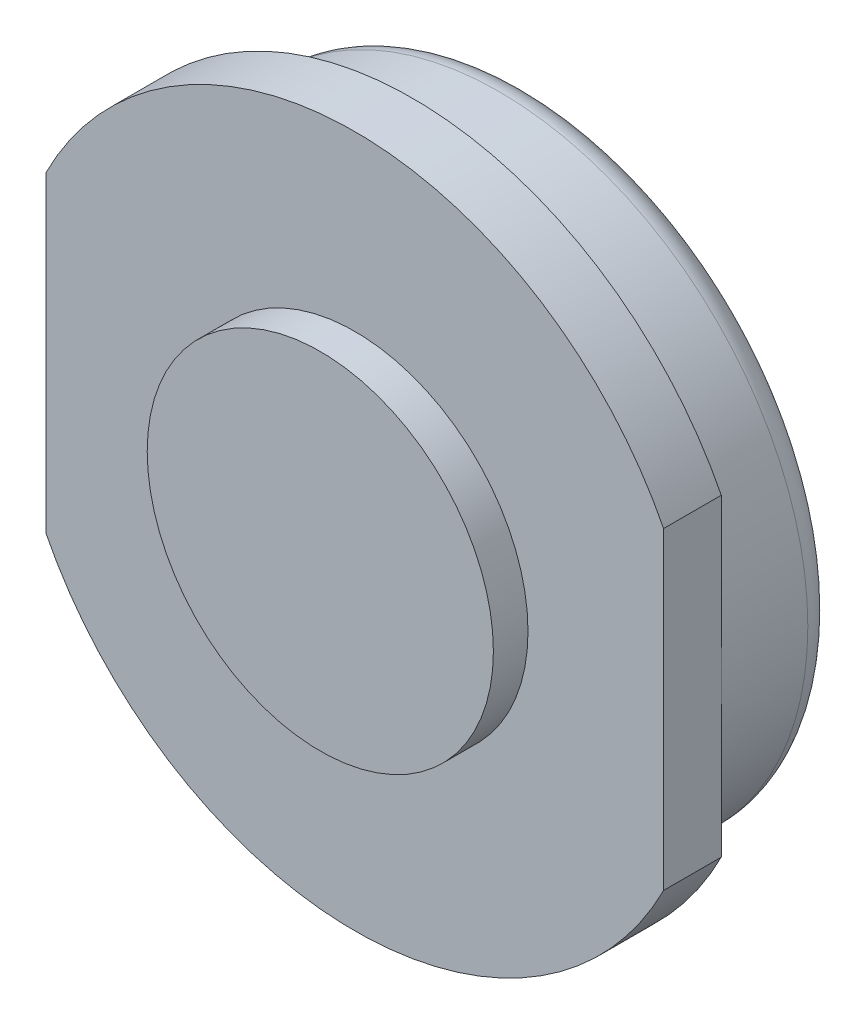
SolidWorks part; units mm, degrees
ref_plane "Спереди" through (0, 0, 0) normal (0, 0, 1) x (1, 0, 0)
ref_plane "Сверху" through (0, 0, 0) normal (0, 1, 0) x (1, 0, 0)
ref_plane "Справа" through (0, 0, 0) normal (1, 0, 0) x (0, 0, -1)
sketch "Эскиз1" plane through (0, 0, 0) normal (0, 0, 1) x (1, 0, 0)
  circle A0 centre (0, 0) radius 5.35
  dimension "D1" = 10.7
extrude "Бобышка-Вытянуть1" add sketch "Эскиз1" along normal blind 2
fillet "Скругление1" radius 0.5 1 edges at (5.35, 0, 0)
sketch "Эскиз2" plane through (0, 0, 2) normal (0, 0, 1) x (1, 0, 0)
  circle A0 centre (0, 0) radius 6
  dimension "D1" = 12
extrude "Бобышка-Вытянуть2" add sketch "Эскиз2" along normal blind 1
sketch "Эскиз3" plane through (0, 0, 2) normal (0, 0, -1) x (-1, 0, 0)
  line L0 (0, 0) -> (0, 6) construction
  line L1 (5.35, 2.7162) -> (5.35, -2.7162)
  line L2 (-5.35, 2.7162) -> (-5.35, -2.7162)
  circle A0 centre (0, 0) radius 6 construction
  arc A1 (-5.35, 2.7162) -> (-5.35, -2.7162) centre (0, 0) ccw
  circle A2 centre (0, 0) radius 5.35 construction
  arc A3 (5.35, -2.7162) -> (5.35, 2.7162) centre (0, 0) ccw
extrude "Вырез-Вытянуть1" cut sketch "Эскиз3" against normal through all
sketch "Эскиз4" plane through (0, 0, 3) normal (0, 0, 1) x (1, 0, 0)
  circle A0 centre (0, 0) radius 3
  dimension "D1" = 6
extrude "Бобышка-Вытянуть3" add sketch "Эскиз4" along normal blind 0.6
